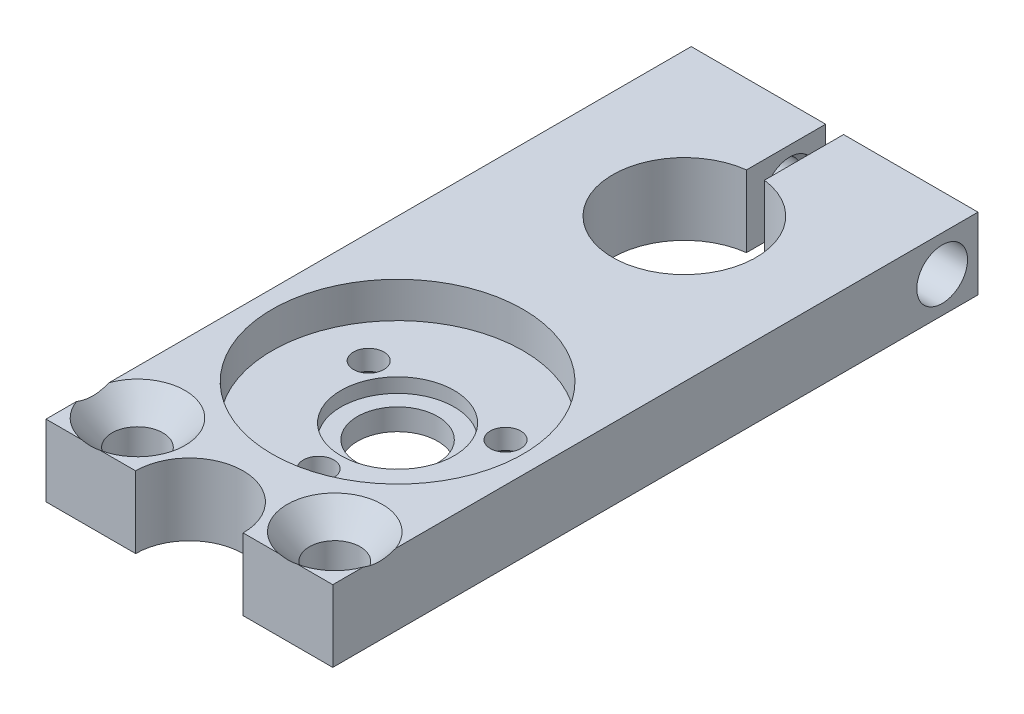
SolidWorks part; units mm, degrees
ref_plane "Front Plane" through (0, 0, 0) normal (0, 0, 1) x (1, 0, 0)
ref_plane "Top Plane" through (0, 0, 0) normal (0, 1, 0) x (1, 0, 0)
ref_plane "Right Plane" through (0, 0, 0) normal (1, 0, 0) x (0, 0, -1)
sketch "Sketch1" plane through (0, 0, 0) normal (1, 0, 0) x (0, 0, -1)
  line L1 (0, 3.175) -> (57.15, 3.175)
  line L2 (0, 3.175) -> (0, -3.175)
  line L3 (0, -3.175) -> (57.15, -3.175)
  line L4 (57.15, 3.175) -> (57.15, -3.175)
  point P4 (0, 0)
  dimension "D1" = 6.35
  dimension "D2" = 57.15
extrude "Extrude1" add sketch "Sketch1" along normal mid plane 25.4
sketch "Sketch2" plane through (0, 3.175, 0) normal (0, 1, 0) x (1, 0, 0)
  line L0 (12.7, 0) -> (-12.7, 0) construction
  circle A0 centre (0, 18.4404) radius 11.1125
  dimension "D2" = 22.225
  dimension "D1" = 18.4404
extrude "Cut-Extrude1" cut sketch "Sketch2" against normal blind 3.175
sketch "Sketch3" plane through (0, 0, 0) normal (0, 1, 0) x (1, 0, 0)
  circle A0 centre (0, 18.4404) radius 5.0165
  dimension "D1" = 10.033
extrude "Cut-Extrude2" cut sketch "Sketch3" against normal blind 1.27
sketch "Sketch4" plane through (0, -1.27, 0) normal (0, 1, 0) x (1, 0, 0)
  circle A0 centre (0, 18.4404) radius 3.556
  dimension "D1" = 7.112
extrude "Cut-Extrude3" cut sketch "Sketch4" against normal up to next
sketch "Sketch5" plane through (0, -3.175, 0) normal (0, -1, 0) x (1, 0, 0)
  circle A0 centre (0, -11.4427) radius 1.016
  circle A1 centre (0, -18.4404) radius 3.556 construction
  circle A2 centre (6.0602, -21.9393) radius 1.016
  circle A3 centre (-6.0602, -21.9392) radius 1.016
  dimension "D1" = 2.032
  dimension "D2" = 6.9977
extrude "Cut-Extrude4" cut sketch "Sketch5" against normal up to next
hole_wizard "CSK for M2.5 Flat Head Machine Screw1" positions "3DSketch1" profile "Sketch6" countersink size "M2.5" standard "Ansi Metric"
sketch3d "3DSketch1"
  line L0 (6.0602, 0, -21.9393) -> (6.0602, -3.175, -21.9393) construction
  line L1 (-6.0602, 0, -21.9392) -> (-6.0602, -3.175, -21.9392) construction
  line L2 (0, 0, -11.4427) -> (0, -3.175, -11.4427) construction
  point P0 (6.0602, -3.175, -21.9393)
  point P2 (-6.0602, -3.175, -21.9392)
  point P4 (0, -3.175, -11.4427)
sketch "Sketch6" plane through (6.0602, -3.175, -21.9393) normal (1, 0, 0) x (0, 0, -1)
  line L0 (0, 0) -> (0, 6.35)
  line L1 (0, 6.35) -> (1.35, 6.35)
  line L2 (1.35, 6.35) -> (1.35, 1.4)
  line L3 (1.35, 1.4) -> (2.75, 0)
  line L5 (2.75, 0) -> (0, 0)
  line L6 (-1.35, 1.4) -> (-2.75, 0) construction
  line L11 (0, -6.35) -> (0, 107.95) construction
  dimension "Thru Hole Dia." = 2.7
  dimension "Thru Hole Depth" = 6.35
  dimension "Near C'Sink Dia." = 5.5
  dimension "Near C'Sink Angle" = 90
sketch "Sketch7" plane through (0, 3.175, 0) normal (0, 1, 0) x (1, 0, 0)
  line L2 (12.7, 57.15) -> (-12.7, 57.15) construction
  line L3 (-0.7938, 57.15) -> (0.7937, 57.15)
  line L4 (-0.7938, 57.15) -> (-0.7937, 50.1406)
  line L6 (0.7937, 57.15) -> (0.7937, 50.1406)
  arc A0 (-0.7937, 50.1406) -> (0.7937, 50.1406) centre (0, 43.8404) ccw
  circle A1 centre (0, 18.4404) radius 3.556 construction
  point P4 (0, 57.15)
  dimension "D1" = 25.4
  dimension "D2" = 12.7
  dimension "D3" = 1.5875
extrude "Cut-Extrude5" cut sketch "Sketch7" against normal up to next
sketch "Sketch12" plane through (0, 3.175, 0) normal (0, 1, 0) x (1, 0, 0)
  circle A0 centre (0, 0) radius 4.7625
  dimension "D1" = 9.525
extrude "Cut-Extrude6" cut sketch "Sketch12" against normal up to next
hole_wizard "#8-32 Tapped Hole3" positions "3DSketch7" profile "Sketch15" tap size "#8-32" standard "Ansi Inch"
sketch3d "3DSketch7"
  point P0 (-0.7938, 0, -53.975)
  dimension "D1" = 3.175
  dimension "D2" = 3.175
sketch "Sketch15" plane through (-0.7938, 0, -53.975) normal (0, 1, 0) x (0, 0, -1)
  line L0 (0, 0) -> (0, 11.9062)
  line L1 (0, 11.9062) -> (1.7272, 11.9062)
  line L2 (1.7272, 11.9062) -> (1.7272, 0)
  line L5 (1.7272, 0) -> (0, 0)
  line L11 (0, -6.35) -> (0, 107.95) construction
  dimension "Thru Tap Drill Dia." = 3.4544
  dimension "Thru Tap Drill Depth" = 11.9062
hole_wizard "#8 Clearance Hole1" positions "3DSketch8" profile "Sketch16" hole size "#8" standard "Ansi Inch"
sketch3d "3DSketch8"
  line L0 (12.7, -3.175, -57.15) -> (12.7, 3.175, -57.15) construction
  line L1 (12.7, 3.175, -57.15) -> (12.7, 3.175, 0) construction
  point P0 (12.7, 0, -53.975)
  dimension "D1" = 3.175
  dimension "D2" = 3.175
sketch "Sketch16" plane through (12.7, 0, -53.975) normal (0, 1, 0) x (0, 0, -1)
  line L0 (0, 0) -> (0, 15.3207)
  line L1 (0, 15.3207) -> (2.2479, 13.97)
  line L2 (2.2479, 13.97) -> (2.2479, 0)
  line L5 (2.2479, 0) -> (0, 0)
  line L10 (0, 15.3207) -> (-2.2479, 13.97) construction
  line L11 (0, -6.35) -> (0, 107.95) construction
  dimension "Hole Dia." = 4.4958
  dimension "Hole Depth" = 13.97
  dimension "Drill Angle" = 118
hole_wizard "CSK for #8 Flat Head Machine Screw1" positions "3DSketch9" profile "Sketch17" countersink size "#8" standard "Ansi Inch"
sketch3d "3DSketch9"
  line L0 (-4.7625, 3.175, 0) -> (-12.7, 3.175, 0) construction
  line L1 (12.7, 3.175, 0) -> (4.7625, 3.175, 0) construction
  line L2 (12.7, 3.175, -57.15) -> (12.7, 3.175, 0) construction
  line L3 (-12.7, 3.175, -57.15) -> (-12.7, 3.175, 0) construction
  point P0 (-8.7376, 3.175, -4.1402)
  point P2 (8.7376, 3.175, -4.1402)
  dimension "D1" = 4.1402
  dimension "D2" = 4.1402
  dimension "D3" = 3.9624
  dimension "D4" = 3.9624
sketch "Sketch17" plane through (-8.7376, 3.175, -4.1402) normal (1, 0, 0) x (0, 0, 1)
  line L0 (0, 0) -> (0, 6.35)
  line L1 (0, 6.35) -> (2.2479, 6.35)
  line L2 (2.2479, 6.35) -> (2.2479, 2.2645)
  line L3 (2.2479, 2.2645) -> (4.2164, 0)
  line L5 (4.2164, 0) -> (0, 0)
  line L6 (-2.2479, 2.2645) -> (-4.2164, 0) construction
  line L11 (0, -6.35) -> (0, 107.95) construction
  dimension "Thru Hole Dia." = 4.4958
  dimension "Thru Hole Depth" = 6.35
  dimension "Near C'Sink Dia." = 8.4328
  dimension "Near C'Sink Angle" = 82
